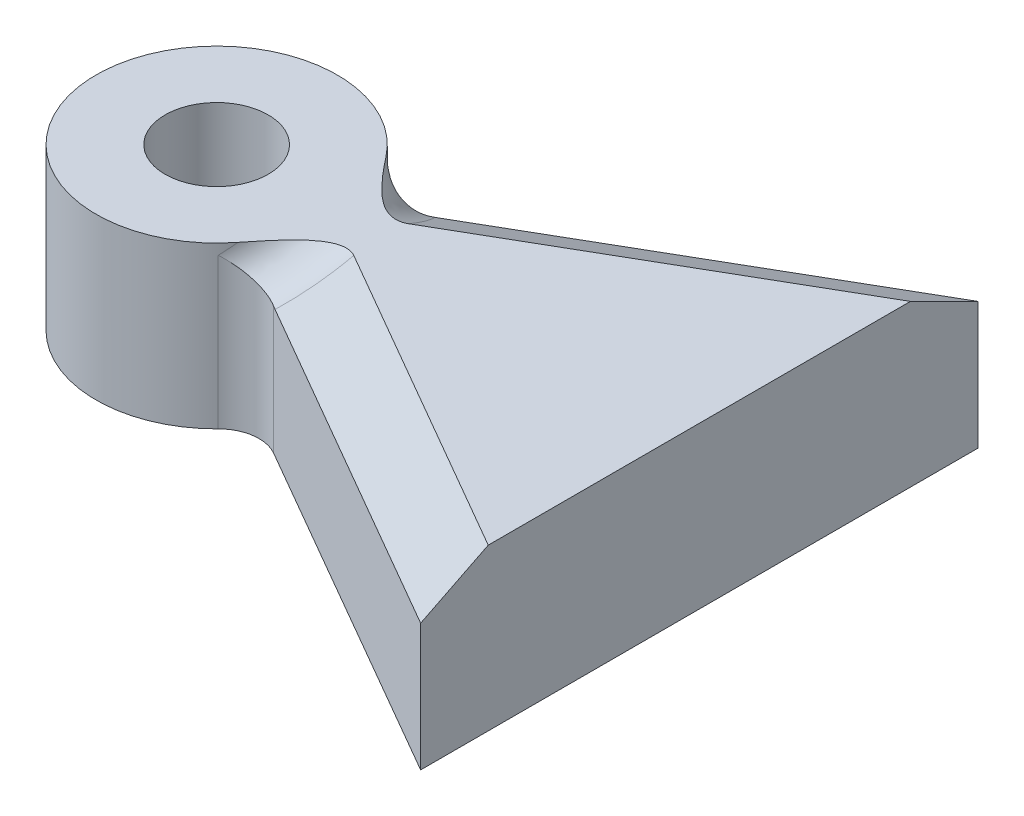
SolidWorks part; units mm, degrees
ref_plane "Front Plane" through (0, 0, 0) normal (0, 0, 1) x (1, 0, 0)
ref_plane "Top Plane" through (0, 0, 0) normal (0, 1, 0) x (1, 0, 0)
ref_plane "Right Plane" through (0, 0, 0) normal (1, 0, 0) x (0, 0, -1)
sketch "Sketch1" plane through (0, 0, 0) normal (0, 1, 0) x (1, 0, 0)
  circle A0 centre (0, 0) radius 8.1359
  circle A1 centre (0, 0) radius 19.05
  dimension "D1" = 16.2719
  dimension "D2" = 38.1
sketch "Sketch2" plane through (0, 0, 0) normal (0, 1, 0) x (1, 0, 0)
  line L0 (8.1359, 4.6973) -> (76.2, 43.9941)
  line L1 (76.2, 43.9941) -> (76.2, -43.9941)
  line L2 (76.2, -43.9941) -> (8.1359, -4.6973)
  line L3 (8.1359, 0) -> (70.5877, 0) construction
  line L4 (8.1359, 4.6973) -> (8.1359, -4.6973)
  circle A0 centre (0, 0) radius 8.1359 construction
  dimension "D1" = 30
  dimension "D2" = 30
extrude "Boss-Extrude1" add sketch "Sketch1" along normal blind 25.4
extrude "Boss-Extrude2" add sketch "Sketch2" along normal blind 25.4
chamfer "Chamfer1" distance 5.334 angle 60 2 edges at (46.3489, 25.4, -26.7595) (46.3489, 25.4, 26.7595)
fillet "Fillet3" radius 6.35 4 edges at (16.4978, 10.033, -9.525) (18.3576, 22.8208, -5.0892) (18.3576, 22.8208, 5.0892) (16.4978, 10.033, 9.525)
